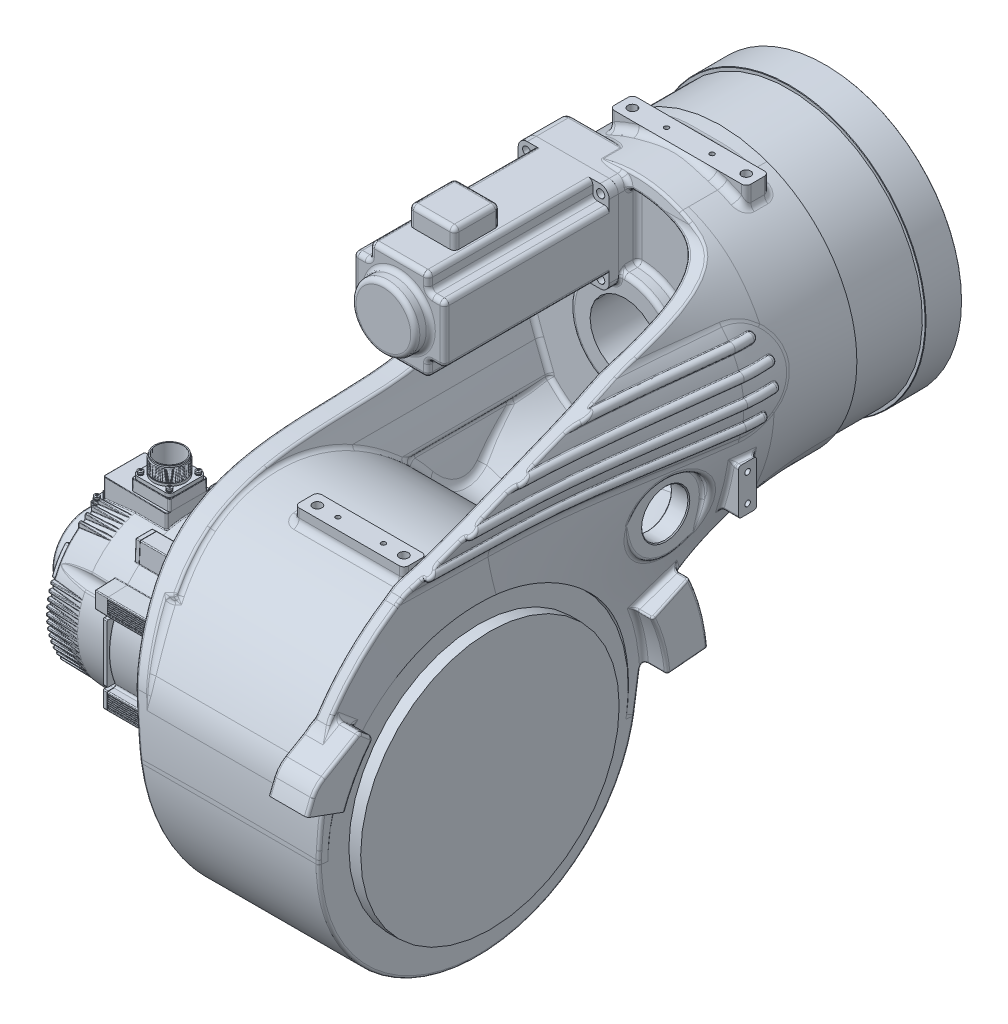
SolidWorks part; units mm, degrees
ref_plane "前视基准面" through (0, 0, 0) normal (0, 0, 1) x (1, 0, 0)
ref_plane "上视基准面" through (0, 0, 0) normal (0, 1, 0) x (1, 0, 0)
ref_plane "右视基准面" through (0, 0, 0) normal (1, 0, 0) x (0, 0, -1)
imported_body "曲面-输入1"
imported_body "曲面-输入2"
imported_body "输入1"
imported_body "输入2"
imported_body "输入3"
imported_body "输入4"
imported_body "输入5"
imported_body "输入6"
imported_body "输入7"
imported_body "输入8"
imported_body "输入9"
imported_body "输入10"
imported_body "输入11"
imported_body "输入12"
imported_body "输入13"
imported_body "输入14"
imported_body "输入15"
imported_body "输入16"
imported_body "输入17"
imported_body "输入18"
imported_body "输入19"
imported_body "输入20"
imported_body "输入21"
imported_body "输入22"
imported_body "输入23"
imported_body "输入24"
imported_body "输入25"
imported_body "输入26"
imported_body "输入27"
imported_body "输入28"
imported_body "输入29"
imported_body "输入30"
imported_body "输入31"
imported_body "输入32"
imported_body "输入33"
imported_body "曲面-输入3"
imported_body "曲面-输入4"
imported_body "曲面-输入5"
imported_body "输入34"
imported_body "输入35"
imported_body "输入36"
imported_body "输入37"
imported_body "输入38"
imported_body "输入39"
imported_body "输入40"
imported_body "输入41"
imported_body "输入42"
imported_body "输入43"
imported_body "输入44"
imported_body "输入45"
imported_body "输入46"
imported_body "输入47"
imported_body "输入48"
imported_body "输入49"
imported_body "输入50"
imported_body "输入51"
imported_body "输入52"
imported_body "输入53"
imported_body "输入54"
imported_body "输入55"
imported_body "输入56"
imported_body "输入57"
imported_body "输入58"
imported_body "输入59"
imported_body "输入60"
imported_body "输入61"
imported_body "输入62"
imported_body "输入63"
imported_body "输入64"
imported_body "输入65"
delete or keep bodies "实体-删除/保留 1" type delete bodies bodies 177
